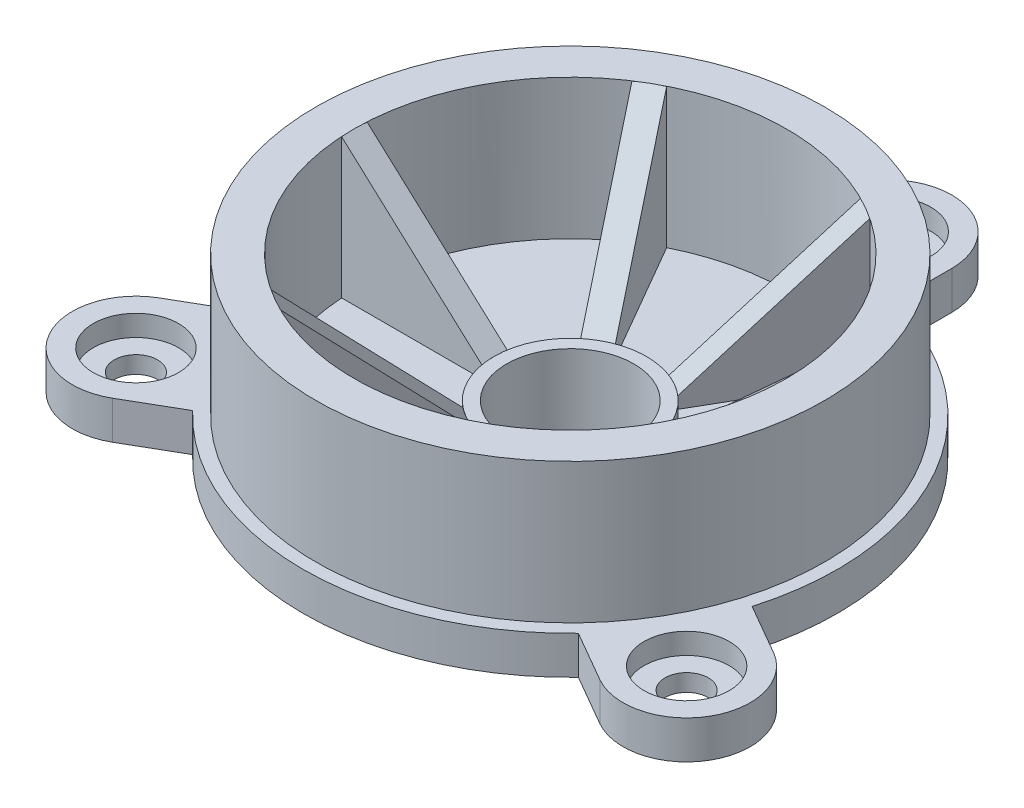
SolidWorks part; units mm, degrees
ref_plane "Front Plane" through (0, 0, 0) normal (0, 0, 1) x (1, 0, 0)
ref_plane "Top Plane" through (0, 0, 0) normal (0, 1, 0) x (1, 0, 0)
ref_plane "Right Plane" through (0, 0, 0) normal (1, 0, 0) x (0, 0, -1)
sketch "Sketch1" plane through (0, 0, 0) normal (1, 0, 0) x (0, 0, -1)
  line L0 (0, 0) -> (0, 43.5809) construction
  line L1 (5, 0) -> (10, 0)
  line L2 (10, 0) -> (10, 2)
  line L3 (10, 2) -> (21, 2)
  line L4 (21, 2) -> (21, 5)
  line L5 (21, 5) -> (20, 5)
  line L6 (20, 5) -> (20, 16)
  line L7 (20, 16) -> (17, 16)
  line L8 (17, 16) -> (17, 5)
  line L9 (17, 5) -> (6, 5)
  line L10 (6, 5) -> (6, 6)
  line L11 (6, 6) -> (5, 6)
  line L12 (5, 6) -> (5, 0)
  dimension "D1" = 10
  dimension "D2" = 20
  dimension "D3" = 42
  dimension "D4" = 3
  dimension "D5" = 2
  dimension "D6" = 1
  dimension "D7" = 11
  dimension "D8" = 12
  dimension "D9" = 34
  dimension "D10" = 40
revolve "Revolve1" add sketch "Sketch1" angle 360 about L0
sketch "Sketch2" plane through (0, 5, 0) normal (0, 1, 0) x (1, 0, 0)
  line L5 (-30.1484, 0) -> (33.107, 0) construction
  line L6 (5, 20.3961) -> (5, 25)
  line L7 (-5, 20.3961) -> (-5, 25)
  line L8 (0, 25) -> (0, 0) construction
  circle A1 centre (0, 0) radius 21 construction
  circle A2 centre (0, 0) radius 25 construction
  arc A4 (-5, 25) -> (5, 25) centre (0, 25) cw
  arc A5 (-5, 20.3961) -> (5, 20.3961) centre (0, 0) cw
  dimension "D1" = 50
  dimension "D2" = 5
extrude "Extrude1" add sketch "Sketch2" against normal up to surface (3 mm away)
hole_wizard "CBORE for M3 SBHCS1" positions "Sketch4" profile "Sketch3" counterbore size "M3" standard "Ansi Metric"
sketch "Sketch4" plane through (0, 5, 0) normal (0, 1, 0) x (-1, 0, 0)
  arc A1 (-5, -25) -> (5, -25) centre (0, -25) ccw construction
  point P0 (0, -25)
sketch "Sketch3" plane through (0, 5, -25) normal (1, 0, 0) x (0, 0, 1)
  line L0 (0, 0) -> (0, 5)
  line L1 (0, 5) -> (1.7, 5)
  line L3 (1.7, 5) -> (1.7, 1.65)
  line L4 (1.7, 1.65) -> (3.35, 1.65)
  line L5 (3.35, 1.65) -> (3.35, 0)
  line L7 (3.35, 0) -> (0, 0)
  line L11 (0, -6.35) -> (0, 107.95) construction
  dimension "Thru Hole Dia." = 3.4
  dimension "Thru Hole Depth" = 5
  dimension "C'Bore Dia." = 6.7
  dimension "C'Bore Depth" = 1.65
pattern_circular "CirPattern1" count 3 over 360 about axis through (0, 0, 0) along (0, 1, 0) of "CBORE for M3 SBHCS1", "Extrude1"
sketch "Sketch5" plane through (0, 0, 0) normal (0, 0, 1) x (1, 0, 0)
  line L0 (-17, 16) -> (-6, 6)
rib "Rib1" sketch "Sketch5" sketch "Sketch5" thickness 2 extrusion direction parallel to sketch draft on no parameters "D1"=2
pattern_circular "CirPattern2" count 6 over 360 about axis through (0, 0, 0) along (0, 1, 0) of "Rib1"
